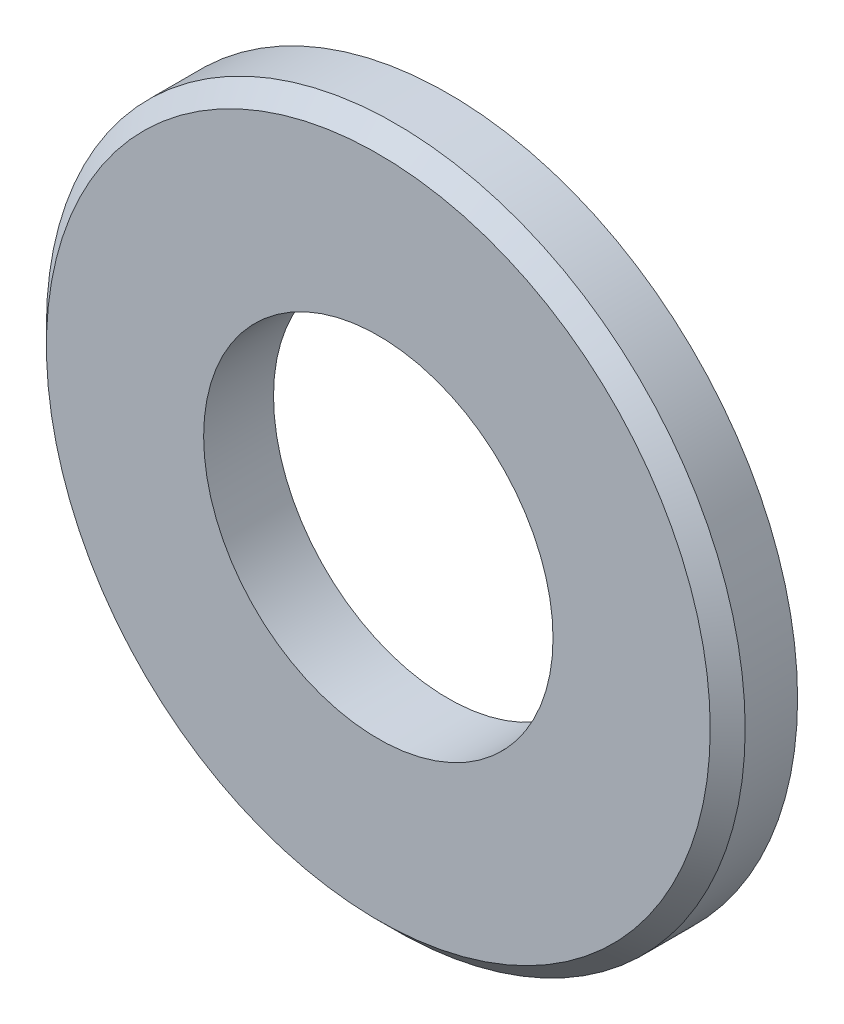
SolidWorks part; units mm, degrees
ref_plane "Front" through (0, 0, 0) normal (0, 0, 1) x (1, 0, 0)
ref_plane "Top" through (0, 0, 0) normal (0, 1, 0) x (1, 0, 0)
ref_plane "Right" through (0, 0, 0) normal (1, 0, 0) x (0, 0, -1)
other "Configuration Table"
sketch "Sketch1" plane through (0, 0, 0) normal (0, 0, 1) x (1, 0, 0)
  circle A0 centre (0, 0) radius 2.5
  circle A1 centre (0, 0) radius 5
  dimension "d1" = 5
  dimension "d2" = 10
extrude "Base-Extrude" add sketch "Sketch1" against normal blind 1
chamfer "Chamfer1" distance 0.25 angle 45 1 edges at (5, 0, 0)
equation "\"c@Chamfer1\"=\"h@Base-Extrude\" / 4"
